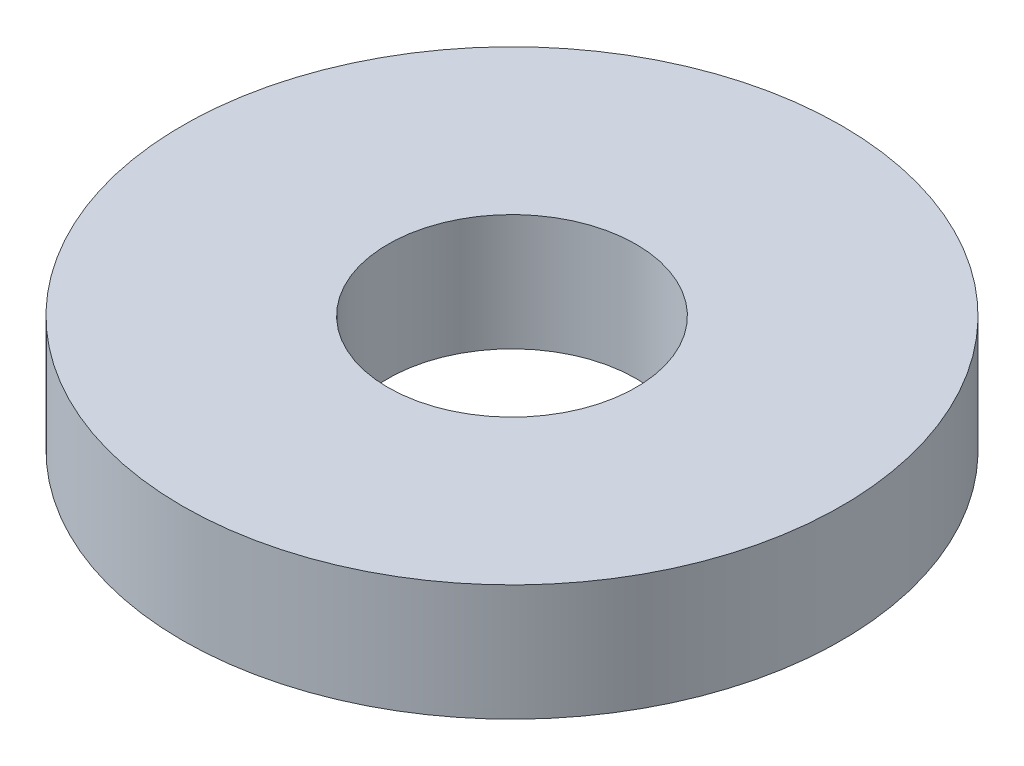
SolidWorks part; units mm, degrees
ref_plane "Aufriss" through (0, 0, 0) normal (0, 0, 1) x (1, 0, 0)
ref_plane "Grundriss" through (0, 0, 0) normal (0, 1, 0) x (1, 0, 0)
ref_plane "Seitenriss" through (0, 0, 0) normal (1, 0, 0) x (0, 0, -1)
sketch "Skizze1" plane through (0, 0, 0) normal (0, 1, 0) x (1, 0, 0)
  circle A0 centre (0, 0) radius 3.2
  circle A1 centre (0, 0) radius 8.5
  dimension "D1" = 6.4
  dimension "D2" = 17
extrude "Aufsatz-Linear austragen1" add sketch "Skizze1" along normal blind 3
